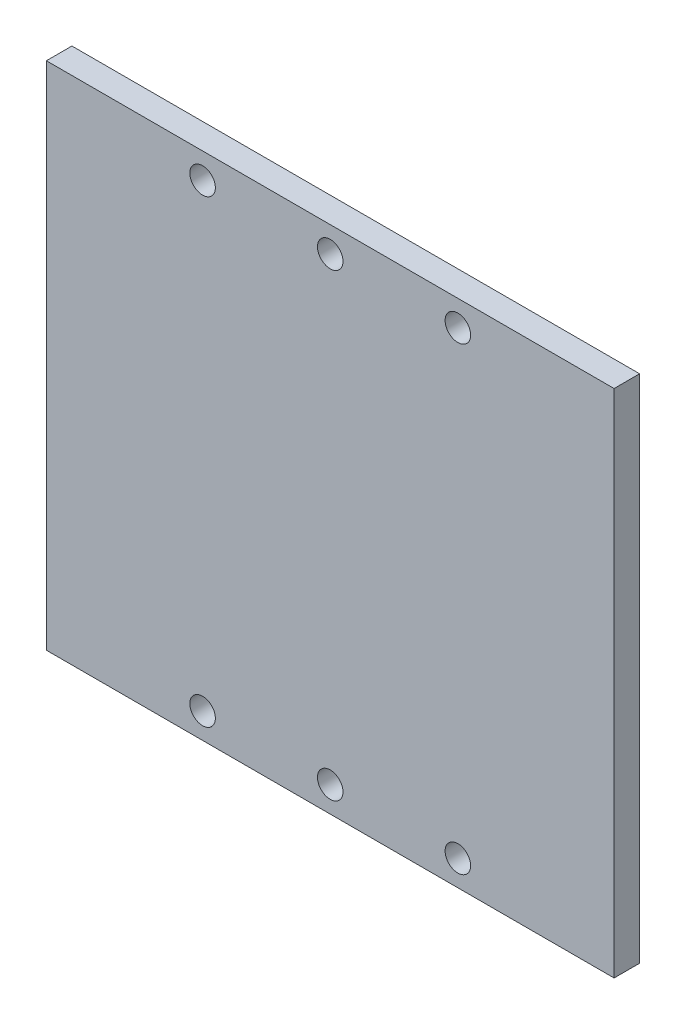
SolidWorks part; units mm, degrees
ref_plane "Front Plane" through (0, 0, 0) normal (0, 0, 1) x (1, 0, 0)
ref_plane "Top Plane" through (0, 0, 0) normal (0, 1, 0) x (1, 0, 0)
ref_plane "Right Plane" through (0, 0, 0) normal (1, 0, 0) x (0, 0, -1)
sketch "Sketch1" plane through (0, 0, 0) normal (0, 0, 1) x (1, 0, 0)
  line L0 (-24.9424, 1) -> (-9.2711, 1)
  line L5 (13.97, 5) -> (13.97, -49) construction
  line L7 (-30.5122, -1) -> (13.97, -1)
  line L8 (-7.2711, 1) -> (8.4003, 1)
  line L9 (-24.9424, -3) -> (-9.2711, -3)
  line L10 (-7.2711, -3) -> (8.4003, -3)
  line L11 (-24.9424, -7) -> (-9.2711, -7)
  line L12 (-7.2711, -7) -> (8.4003, -7)
  line L13 (-24.9424, -11) -> (-9.2711, -11)
  line L14 (-7.2711, -11) -> (8.4003, -11)
  line L15 (-24.9424, -15) -> (-9.2711, -15)
  line L16 (-7.2711, -15) -> (8.4003, -15)
  line L17 (-24.9424, -19) -> (-9.2711, -19)
  line L18 (-7.2711, -19) -> (8.4003, -19)
  line L19 (-24.9424, -23) -> (-9.2711, -23)
  line L20 (-7.2711, -23) -> (8.4003, -23)
  line L21 (-24.9424, -27) -> (-9.2711, -27)
  line L22 (-7.2711, -27) -> (8.4003, -27)
  line L23 (-24.9424, -31) -> (-9.2711, -31)
  line L24 (-7.2711, -31) -> (8.4003, -31)
  line L37 (-30.5122, -5) -> (13.97, -5)
  line L38 (-30.5122, -9) -> (13.97, -9)
  line L39 (-30.5122, -13) -> (13.97, -13)
  line L40 (-30.5122, -17) -> (13.97, -17)
  line L41 (-30.5122, -21) -> (13.97, -21)
  line L42 (-30.5122, -25) -> (13.97, -25)
  line L43 (-30.5122, -29) -> (13.97, -29)
  point P0 (0, 0)
sketch "Croquis1" plane through (0, 0, 0) normal (0, 0, 1) x (1, 0, 0)
  line L0 (-7.2711, 1) -> (8.4003, 1) construction
  line L1 (-30.51, 5) -> (13.97, 5)
  line L2 (-30.51, 5) -> (-30.51, -35)
  line L3 (-30.51, -35) -> (13.97, -35)
  line L4 (13.97, 5) -> (13.97, -35)
  line L5 (13.97, -15) -> (-30.51, -15) construction
  circle A1 centre (-8.27, -33) radius 1
  circle A2 centre (1.73, -33) radius 1
  circle A3 centre (-18.27, -33) radius 1
  circle A7 centre (1.73, 3) radius 1
  circle A8 centre (-8.27, 3) radius 1
  circle A9 centre (-18.27, 3) radius 1
  point P4 (-8.27, 5)
  point P8 (0.5646, 1)
extrude "Saliente-Extruir2" add sketch "Croquis1" along normal blind 2
equation "\"T\"= 2'Material thickness (mm)"
equation "\"k\"= 0.2'kerf mm"
equation "\"theta\"= 180'Total bend angle DEG"
equation "\"theta_rad\"= 3.14159 * \"theta\" / 180'Total bend angle RAD"
equation "\"n\"= round ( ( \"theta_rad\" / ( 3.14159 / 4 - arccos ( ( \"k\" + \"T\" ) / ( 2 * sqr ( ( \"T\" ^ 2 ) / 2 ) ) ) ) ) / 2 )'Minimum number of columns of torsional links"
equation "\"tallow\"= 20'Torsional Stress Allowed MPA"
equation "\"G\"= 1500'Torsional Modulus of the material (Pa)"
equation "\"l\"= 0.676125 * ( \"theta_rad\" * \"G\" * \"T\" ) / ( \"tallow\" * \"n\" )"
equation "\"D1@Sketch1\"=\"T\""
equation "\"D2@Sketch1\"=\"l\""
equation "\"D3@Sketch1\"=\"l\""
equation "\"D4@Sketch1\"=\"T\""
equation "\"D7@Sketch1\"=\"n\"/2 + 1"
equation "\"D9@Sketch1\"=\"n\"/2"
equation "\"D11@Sketch1\"=\"T\"*2"
equation "\"D10@Sketch1\"=\"T\"*2"
equation "\"distancia_rectangulo\"= 44.48'Ancho del rectangulo"
equation "\"D1@Croquis1\"=\"distancia_rectangulo\""
equation "\"largo_rectangulo\"= \"T\" * \"n\" + 10'altura total del rectangulo"
equation "\"D2@Croquis1\"=\"largo_rectangulo\""
equation "\"D1@Saliente-Extruir2\"=\"T\""
equation "\"D9@Croquis1\"=\"largo_rectangulo\"/2"
